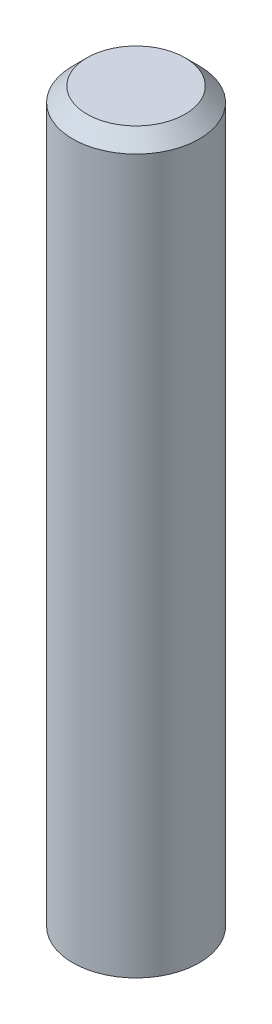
SolidWorks part; units mm, degrees
ref_plane "Front Plane" through (0, 0, 0) normal (0, 0, 1) x (1, 0, 0)
ref_plane "Top Plane" through (0, 0, 0) normal (0, 1, 0) x (1, 0, 0)
ref_plane "Right Plane" through (0, 0, 0) normal (1, 0, 0) x (0, 0, -1)
sketch "Sketch1" plane through (0, 0, 0) normal (0, 1, 0) x (1, 0, 0)
  circle A0 centre (0, 0) radius 1.25
  dimension "D1" = 2.5
extrude "Boss-Extrude1" add sketch "Sketch1" along normal blind 11.5
other "M2x0.4 Machine Threads Stud1" parameters "D1"=2, "D2"=10, "D3"=11.5, "D4"=2.5
sketch "Sketch2" plane through (0, 11.5, 0) normal (1, 0, 0) x (0, 0, -1)
  line L5 (0, -14.3089) -> (0, 0) construction
  line L6 (0.774, 0) -> (1, -0.226)
  line L9 (1, -0.226) -> (1, -11.5)
  line L10 (0.774, 0) -> (1.25, 0)
  line L11 (1.25, 0) -> (1.25, -11.5)
  line L12 (1, -11.5) -> (1.25, -11.5)
  dimension "Minor Diameter" = 1.548
  dimension "Major Diameter" = 2
  dimension "Thread Length" = 11.5
  dimension "Cylinder Diameter" = 2.5
  dimension "Chamfer Angle" = 45
sketch "Sketch3" plane through (0, 0, 0) normal (0, -1, 0) x (1, 0, 0)
  line L1 (-0.5992, -0.3478) -> (0.0016, -0.6928)
  line L2 (0.0016, -0.6928) -> (0.6008, -0.345)
  line L3 (0.6008, -0.345) -> (0.5992, 0.3478)
  line L4 (0.5992, 0.3478) -> (-0.0016, 0.6928)
  line L5 (-0.0016, 0.6928) -> (-0.6008, 0.345)
  line L6 (-0.6008, 0.345) -> (-0.5992, -0.3478)
  circle A0 centre (0, 0) radius 0.6 construction
extrude "Cut-Extrude1" cut sketch "Sketch3" against normal blind 1
